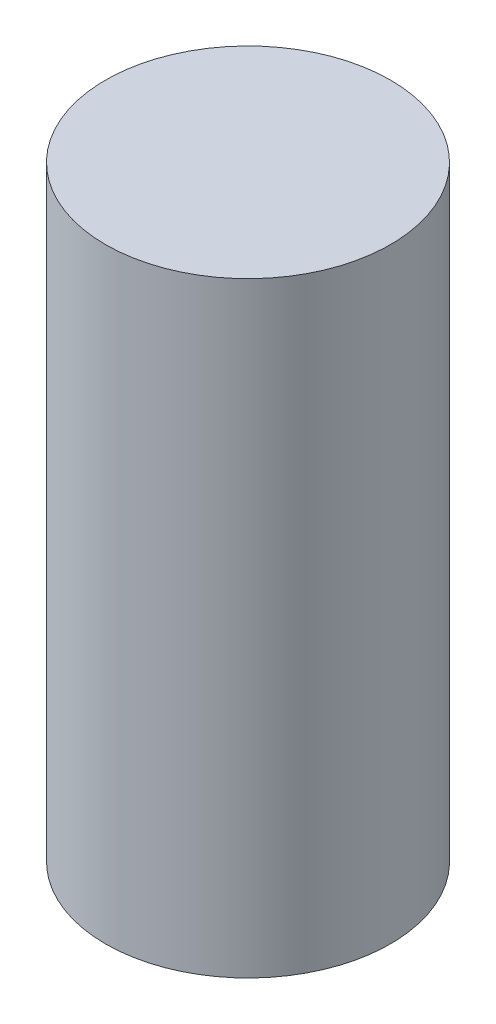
SolidWorks part; units mm, degrees
ref_plane "前视基准面" through (0, 0, 0) normal (0, 0, 1) x (1, 0, 0)
ref_plane "上视基准面" through (0, 0, 0) normal (0, 1, 0) x (1, 0, 0)
ref_plane "右视基准面" through (0, 0, 0) normal (1, 0, 0) x (0, 0, -1)
other "Configuration Table"
sketch "草图1" plane through (0, 0, 0) normal (0, 1, 0) x (1, 0, 0)
  circle A0 centre (0, 0) radius 20
extrude "凸台-拉伸1" add sketch "草图1" along normal blind 85
